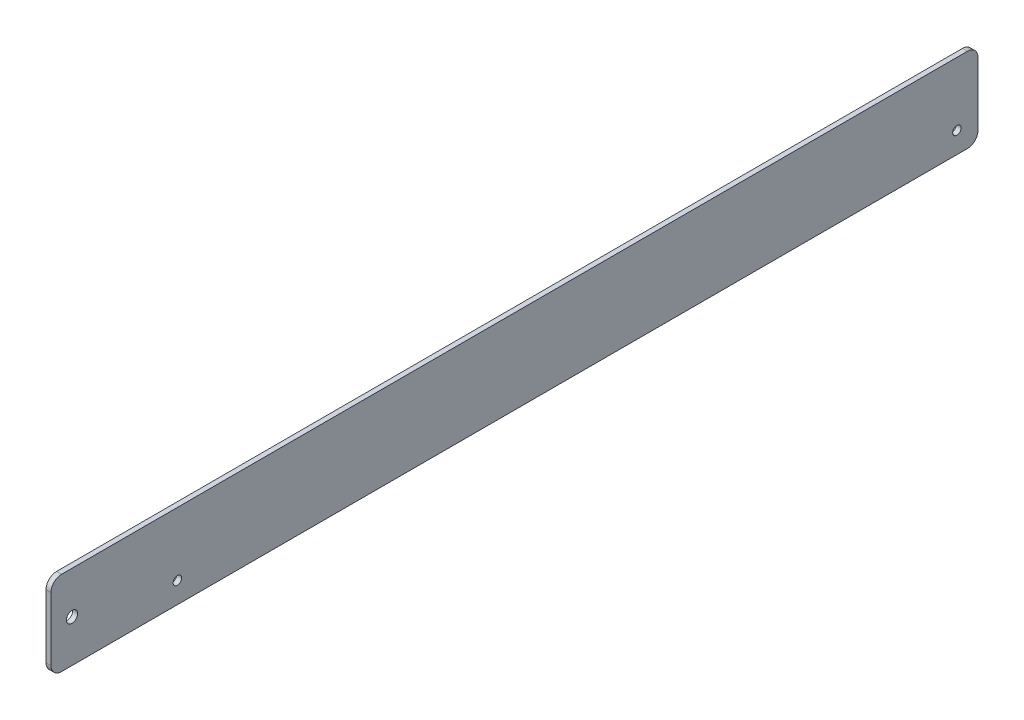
SolidWorks part; units mm, degrees
ref_plane "Front Plane" through (0, 0, 0) normal (0, 0, 1) x (1, 0, 0)
ref_plane "Top Plane" through (0, 0, 0) normal (0, 1, 0) x (1, 0, 0)
ref_plane "Right Plane" through (0, 0, 0) normal (1, 0, 0) x (0, 0, -1)
sketch "Sketch1" plane through (0, 0, 0) normal (1, 0, 0) x (0, 0, -1)
  line L1 (-279.4, 25.4) -> (279.4, 25.4)
  line L2 (-279.4, 25.4) -> (-279.4, -25.4)
  line L3 (-279.4, -25.4) -> (279.4, -25.4)
  line L4 (279.4, 25.4) -> (279.4, -25.4)
  line L5 (-279.4, 25.4) -> (279.4, -25.4) construction
  line L6 (-279.4, -25.4) -> (279.4, 25.4) construction
  point P0 (0, 0)
  dimension "D1" = 50.8
  dimension "D2" = 558.8
extrude "Boss-Extrude1" add sketch "Sketch1" along normal blind 2.9972
hole_wizard "#7 (0.201) Diameter Hole1" positions "Sketch2" profile "Sketch3" hole size "#7" standard "ANSI Inch"
sketch "Sketch2" plane through (2.9972, 0, 0) normal (1, 0, 0) x (0, 0, -1)
  line L0 (-279.4, -25.4) -> (279.4, -25.4) construction
  line L1 (279.4, -25.4) -> (279.4, 25.4) construction
  point P0 (-203.2, -12.7)
  point P2 (266.7, -12.7)
  dimension "D1" = 12.7
  dimension "D2" = 469.9
  dimension "D3" = 12.7
sketch "Sketch3" plane through (2.9972, -12.7, 203.2) normal (0, 1, 0) x (0, 0, -1)
  line L0 (0, 0) -> (0, 2.9972)
  line L1 (0, 2.9972) -> (2.5527, 2.9972)
  line L2 (2.5527, 2.9972) -> (2.5527, 0)
  line L5 (2.5527, 0) -> (0, 0)
  line L11 (0, -6.35) -> (0, 107.95) construction
  dimension "Thru Hole Dia." = 5.1054
  dimension "Thru Hole Depth" = 2.9972
hole_wizard "17/64 (0.26563) Diameter Hole1" positions "Sketch4" profile "Sketch5" hole size "17/64" standard "ANSI Inch"
sketch "Sketch4" plane through (2.9972, 0, 0) normal (1, 0, 0) x (0, 0, -1)
  line L2 (-279.4, -25.4) -> (279.4, -25.4) construction
  line L3 (-279.4, 25.4) -> (-279.4, -25.4) construction
  point P0 (-266.7, 0)
  point P9 (0, 0)
  dimension "D1" = 25.4
  dimension "D2" = 12.7
sketch "Sketch5" plane through (2.9972, 0, 266.7) normal (0, 1, 0) x (0, 0, -1)
  line L0 (0, 0) -> (0, 2.9972)
  line L1 (0, 2.9972) -> (3.3735, 2.9972)
  line L2 (3.3735, 2.9972) -> (3.3735, 0)
  line L5 (3.3735, 0) -> (0, 0)
  line L11 (0, -6.35) -> (0, 107.95) construction
  dimension "Thru Hole Dia." = 6.747
  dimension "Thru Hole Depth" = 2.9972
fillet "Fillet1" radius 6.35 4 edges at (1.4986, -25.4, -279.4) (1.4986, 25.4, -279.4) (1.4986, -25.4, 279.4) (1.4986, 25.4, 279.4)
